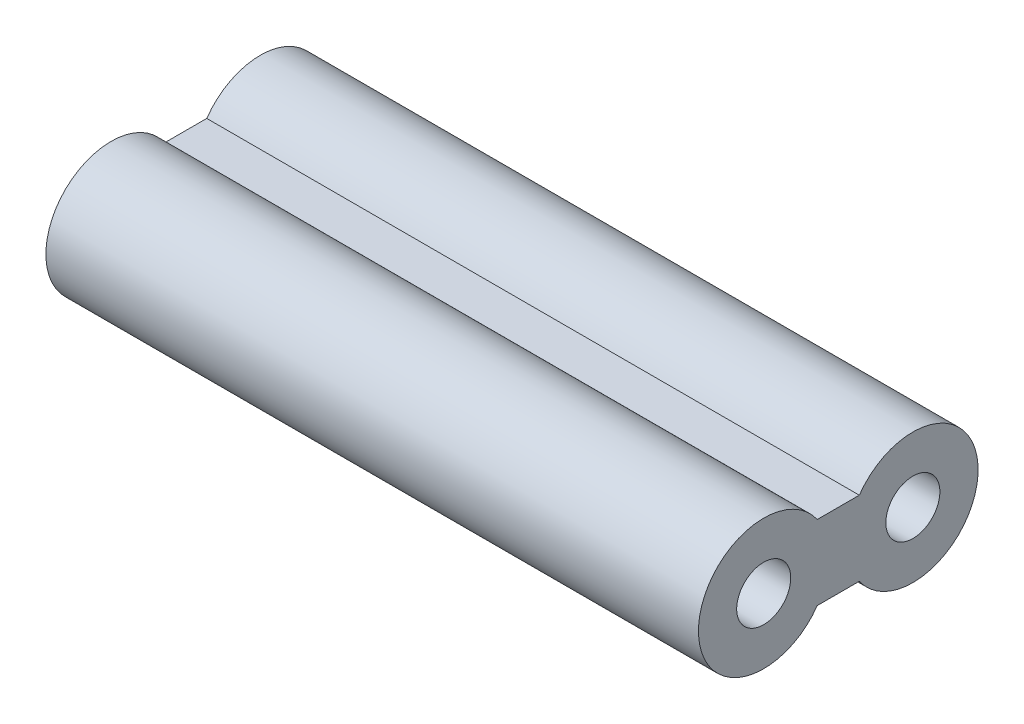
SolidWorks part; units mm, degrees
ref_plane "Front" through (0, 0, 0) normal (0, 0, 1) x (1, 0, 0)
ref_plane "Top" through (0, 0, 0) normal (0, 1, 0) x (1, 0, 0)
ref_plane "Right" through (0, 0, 0) normal (1, 0, 0) x (0, 0, -1)
sketch "Sketch1" plane through (0, 0, 0) normal (1, 0, 0) x (0, 0, -1)
  circle A0 centre (0, 0) radius 3.5
  circle A1 centre (0, 0) radius 1.45
  dimension "D1" = 7
  dimension "D2" = 2.9
extrude "Boss-Extrude1" add sketch "Sketch1" along normal mid plane 35
sketch "Sketch2" plane through (17.5, 0, 0) normal (1, 0, 0) x (0, 0, -1)
  line L0 (3.5, 0) -> (8, 0) construction
  line L1 (2.8723, -2) -> (5.1277, -2)
  line L2 (2.8723, 2) -> (5.1277, 2)
  line L3 (4, -2) -> (6, -2) construction
  line L4 (4, 2) -> (6, 2) construction
  line L5 (4, 0) -> (6, 0) construction
  circle A0 centre (8, 0) radius 1.45
  arc A1 (5.1277, -2) -> (5.1277, 2) centre (8, 0) ccw
  circle A3 centre (0, 0) radius 3.5 construction
  circle A4 centre (0, 0) radius 1.45 construction
  arc A5 (2.8723, -2) -> (2.8723, 2) centre (0, 0) ccw
  dimension "D4" = 8
  dimension "D2" = 2
  dimension "D3" = 2
extrude "Boss-Extrude2" add sketch "Sketch2" against normal up to surface (35 mm away)
